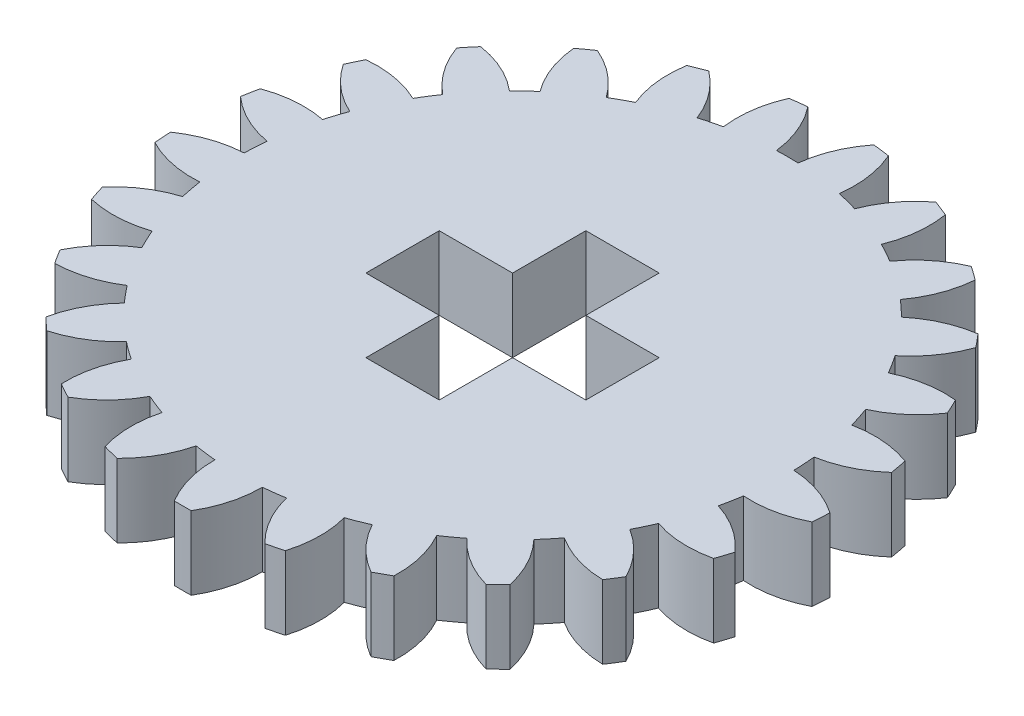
SolidWorks part; units mm, degrees
ref_plane "Alzado" through (0, 0, 0) normal (0, 0, 1) x (1, 0, 0)
ref_plane "Planta" through (0, 0, 0) normal (0, 1, 0) x (1, 0, 0)
ref_plane "Vista lateral" through (0, 0, 0) normal (1, 0, 0) x (0, 0, -1)
sketch "Croquis1" plane through (0, 0, 0) normal (0, 1, 0) x (1, 0, 0)
  circle A0 centre (0, 0) radius 13.5
  dimension "De" = 27
extrude "Saliente-Extruir1" add sketch "Croquis1" along normal blind 3
sketch "Croquis2" plane through (0, 3, 0) normal (0, 1, 0) x (1, 0, 0)
  line L0 (0, 0) -> (0, 68.4929) construction
  line L1 (0.7854, 12.5) -> (4.7594, 10.7387) construction
  circle A0 centre (0, 0) radius 12.5 construction
  circle A1 centre (0, 0) radius 11.25 construction
  circle A2 centre (0, 0) radius 11.7462 construction
  circle A3 centre (0, 12.5) radius 0.7854 construction
  arc A4 (0.4417, 11.2413) -> (1.3479, 13.4325) centre (4.7594, 10.7387) cw
  circle A5 centre (0, 0) radius 13.5 construction
  arc A7 (-0.4417, 11.2413) -> (-1.3479, 13.4325) centre (-4.7594, 10.7387) ccw
  arc A8 (-0.4417, 11.2413) -> (0.4417, 11.2413) centre (0, 0) cw
  arc A9 (1.3479, 13.4325) -> (-1.3479, 13.4325) centre (0, 0) ccw
  dimension "Dp" = 25
  dimension "Df" = 22.5
  dimension "Ct" = 23.4923
  dimension "C" = 1.5708
extrude "Cortar-Extruir1" cut sketch "Croquis2" against normal up to surface (3 mm away)
pattern_circular "MatrizC1" count 25 over 360 about axis through (0, 0, 0) along (0, 1, 0) of "Cortar-Extruir1"
sketch "Croquis3" plane through (0, 3, 0) normal (0, 1, 0) x (1, 0, 0)
  line L0 (-1.5, 1.5) -> (-1.5, 4.5)
  line L1 (1.5, -4.5) -> (-1.5, -4.5)
  line L2 (1.5, -4.5) -> (1.5, -1.5)
  line L3 (1.5, 4.5) -> (-1.5, 4.5)
  line L4 (-1.5, -4.5) -> (-1.5, -1.5)
  line L5 (1.5, -4.5) -> (-1.5, 4.5) construction
  line L6 (1.5, 4.5) -> (-1.5, -4.5) construction
  line L7 (4.5, -1.5) -> (1.5, -1.5)
  line L8 (4.5, -1.5) -> (4.5, 1.5)
  line L9 (4.5, 1.5) -> (1.5, 1.5)
  line L10 (-4.5, -1.5) -> (-4.5, 1.5)
  line L11 (4.5, -1.5) -> (-4.5, 1.5) construction
  line L12 (4.5, 1.5) -> (-4.5, -1.5) construction
  line L13 (-1.5, 1.5) -> (-4.5, 1.5)
  line L14 (-1.5, -1.5) -> (-4.5, -1.5)
  line L15 (1.5, 1.5) -> (1.5, 4.5)
  point P0 (0, 0)
  point P6 (0, 0)
  dimension "D1" = 9
  dimension "D2" = 3
  dimension "D3" = 3
  dimension "D4" = 9
extrude "Cortar-Extruir2" cut sketch "Croquis3" against normal up to surface (3 mm away)
sketch "Croquis4" [suppressed] plane through (0, 8, 0) normal (0, 1, 0) x (1, 0, 0)
  circle A0 centre (0, 0) radius 4.7434
extrude "Cortar-Extruir3" [suppressed] cut sketch "Croquis4" against normal up to surface (8 mm away)
extrude "Cortar-Extruir4" cut sketch "Croquis5" against normal through all both and the other way through all
sketch "Croquis5" plane through (-11.6802, 3, -24.565) normal (0, 1, 0) x (0.8363, 0, -0.5483)
  arc A120 (0.3644, -31.6955) -> (2.4205, -32.8458) centre (2.5692, -30.1672) ccw
  arc A121 (2.4205, -32.8458) -> (2.8055, -32.4182) centre (-3.7001, -26.9476) ccw
  arc A122 (2.8055, -32.4182) -> (1.4466, -30.4936) centre (0.1571, -32.846) ccw
  arc A123 (1.4466, -30.4936) -> (1.9441, -29.6318) centre (-3.7001, -26.9476) ccw
  arc A124 (1.9441, -29.6318) -> (4.2903, -29.8464) centre (3.3367, -27.3389) ccw
  arc A125 (4.2903, -29.8464) -> (4.4681, -29.2991) centre (-3.7001, -26.9476) ccw
  arc A126 (4.4681, -29.2991) -> (2.4439, -28.0936) centre (2.2228, -30.7672) ccw
  arc A127 (2.4439, -28.0936) -> (2.5479, -27.104) centre (-3.7001, -26.9476) ccw
  arc A128 (2.5479, -27.104) -> (4.7785, -26.3457) centre (2.8875, -24.4429) ccw
  arc A129 (4.7785, -26.3457) -> (4.7184, -25.7735) centre (-3.7001, -26.9476) ccw
  arc A130 (4.7184, -25.7735) -> (2.3789, -25.4956) centre (3.2643, -28.0279) ccw
  arc A131 (2.3789, -25.4956) -> (2.0714, -24.5492) centre (-3.7001, -26.9476) ccw
  arc A132 (2.0714, -24.5492) -> (3.8007, -22.9492) centre (1.2992, -21.98) ccw
  arc A133 (3.8007, -22.9492) -> (3.513, -22.4509) centre (-3.7001, -26.9476) ccw
  arc A134 (3.513, -22.4509) -> (1.2627, -23.1486) centre (3.1016, -25.1019) ccw
  arc A135 (1.2627, -23.1486) -> (0.5969, -22.4091) centre (-3.7001, -26.9476) ccw
  arc A136 (0.5969, -22.4091) -> (1.5259, -20.244) centre (-1.1535, -20.3761) ccw
  arc A137 (1.5259, -20.244) -> (1.0604, -19.9058) centre (-3.7001, -26.9476) ccw
  arc A138 (1.0604, -19.9058) -> (-0.7116, -21.4584) centre (1.7628, -22.4949) ccw
  arc A139 (-0.7116, -21.4584) -> (-1.6206, -21.0537) centre (-3.7001, -26.9476) ccw
  arc A140 (-1.6206, -21.0537) -> (-1.6525, -18.6979) centre (-4.0466, -19.9084) ccw
  arc A141 (-1.6525, -18.6979) -> (-2.2153, -18.5783) centre (-3.7001, -26.9476) ccw
  arc A142 (-2.2153, -18.5783) -> (-3.2026, -20.7174) centre (-0.5206, -20.6579) ccw
  arc A143 (-3.2026, -20.7174) -> (-4.1977, -20.7174) centre (-3.7001, -26.9476) ccw
  arc A144 (-4.1977, -20.7174) -> (-5.185, -18.5783) centre (-6.8797, -20.6579) ccw
  arc A145 (-5.185, -18.5783) -> (-5.7478, -18.6979) centre (-3.7001, -26.9476) ccw
  arc A146 (-5.7478, -18.6979) -> (-5.7797, -21.0537) centre (-3.3537, -19.9084) ccw
  arc A147 (-5.7797, -21.0537) -> (-6.6887, -21.4584) centre (-3.7001, -26.9476) ccw
  arc A148 (-6.6887, -21.4584) -> (-8.4607, -19.9058) centre (-9.1631, -22.4949) ccw
  arc A149 (-8.4607, -19.9058) -> (-8.9262, -20.244) centre (-3.7001, -26.9476) ccw
  arc A150 (-8.9262, -20.244) -> (-7.9971, -22.4091) centre (-6.2467, -20.3761) ccw
  arc A151 (-7.9971, -22.4091) -> (-8.663, -23.1486) centre (-3.7001, -26.9476) ccw
  arc A152 (-8.663, -23.1486) -> (-10.9133, -22.4509) centre (-10.5018, -25.1019) ccw
  arc A153 (-10.9133, -22.4509) -> (-11.201, -22.9492) centre (-3.7001, -26.9476) ccw
  arc A154 (-11.201, -22.9492) -> (-9.4716, -24.5492) centre (-8.6995, -21.98) ccw
  arc A155 (-9.4716, -24.5492) -> (-9.7791, -25.4956) centre (-3.7001, -26.9476) ccw
  arc A156 (-9.7791, -25.4956) -> (-12.1187, -25.7735) centre (-10.6645, -28.0279) ccw
  arc A157 (-12.1187, -25.7735) -> (-12.1788, -26.3457) centre (-3.7001, -26.9476) ccw
  arc A158 (-12.1788, -26.3457) -> (-9.9482, -27.104) centre (-10.2877, -24.4429) ccw
  arc A159 (-9.9482, -27.104) -> (-9.8442, -28.0936) centre (-3.7001, -26.9476) ccw
  arc A160 (-9.8442, -28.0936) -> (-11.8684, -29.2991) centre (-9.623, -30.7672) ccw
  arc A161 (-11.8684, -29.2991) -> (-11.6906, -29.8464) centre (-3.7001, -26.9476) ccw
  arc A162 (-11.6906, -29.8464) -> (-9.3444, -29.6318) centre (-10.737, -27.3389) ccw
  arc A163 (-9.3444, -29.6318) -> (-8.8468, -30.4936) centre (-3.7001, -26.9476) ccw
  arc A164 (-8.8468, -30.4936) -> (-10.2057, -32.4182) centre (-7.5574, -32.846) ccw
  arc A165 (-10.2057, -32.4182) -> (-9.8207, -32.8458) centre (-3.7001, -26.9476) ccw
  arc A166 (-9.8207, -32.8458) -> (-7.7646, -31.6955) centre (-9.9694, -30.1672) ccw
  arc A167 (-7.7646, -31.6955) -> (-6.9596, -32.2804) centre (-3.7001, -26.9476) ccw
  arc A168 (-6.9596, -32.2804) -> (-7.4182, -34.5913) centre (-4.8248, -33.905) ccw
  arc A169 (-7.4182, -34.5913) -> (-6.8926, -34.8253) centre (-3.7001, -26.9476) ccw
  arc A170 (-6.8926, -34.8253) -> (-5.4821, -32.9382) centre (-8.1179, -32.4388) ccw
  arc A171 (-5.4821, -32.9382) -> (-4.5088, -33.1451) centre (-3.7001, -26.9476) ccw
  arc A172 (-4.5088, -33.1451) -> (-3.9878, -35.4427) centre (-1.8978, -33.7609) ccw
  arc A173 (-3.9878, -35.4427) -> (-3.4124, -35.4427) centre (-3.7001, -26.9476) ccw
  arc A174 (-3.4124, -35.4427) -> (-2.8915, -33.1451) centre (-5.5025, -33.7609) ccw
  arc A175 (-2.8915, -33.1451) -> (-1.9181, -32.9382) centre (-3.7001, -26.9476) ccw
  arc A176 (-1.9181, -32.9382) -> (-0.5077, -34.8253) centre (0.7177, -32.4388) ccw
  arc A177 (-0.5077, -34.8253) -> (0.018, -34.5913) centre (-3.7001, -26.9476) ccw
  arc A178 (0.018, -34.5913) -> (-0.4406, -32.2804) centre (-2.5755, -33.905) ccw
  arc A179 (-0.4406, -32.2804) -> (0.3644, -31.6955) centre (-3.7001, -26.9476) ccw
